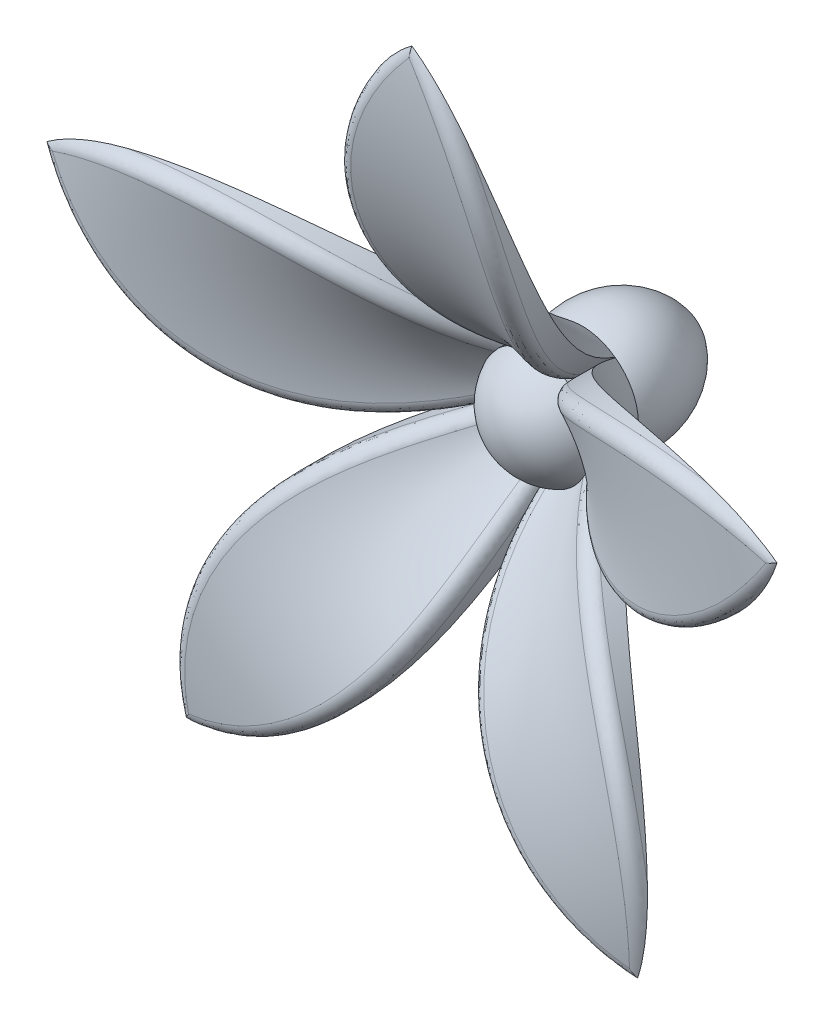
SolidWorks part; units mm, degrees
ref_plane "正面" through (0, 0, 0) normal (0, 0, 1) x (1, 0, 0)
ref_plane "平面" through (0, 0, 0) normal (0, 1, 0) x (1, 0, 0)
ref_plane "右側面" through (0, 0, 0) normal (1, 0, 0) x (0, 0, -1)
sketch "ｽｹｯﾁ1" plane through (0, 0, 0) normal (1, 0, 0) x (0, 0, -1)
  line L0 (22.5323, 0) -> (-103.6484, 0) construction
  line L1 (-20, 0) -> (0, 0)
  arc A0 (0, 0) -> (-110, 157.5) centre (59.9928, 159.0624) cw
  arc A1 (-20, 0) -> (-110, 157.5) centre (25.3033, 130.3519) cw
  dimension "D2" = 170
  dimension "D3" = 138
  dimension "D1" = 110
  dimension "D4" = 315
  dimension "D5" = 20
revolve "回転1" add sketch "ｽｹｯﾁ1" angle 360 about L0
sketch "ｽｹｯﾁ2" plane through (0, 0, 0) normal (0, 0, 1) x (1, 0, 0)
  line L0 (0, 0) -> (0, 196.031) construction
  line L1 (-11.0556, 15.2167) -> (11.0556, 15.2167)
  line L2 (0, 0) -> (62.3495, 85.8167) construction
  line L3 (0, 0) -> (-62.3495, 85.8167) construction
  arc A0 (0, 157.5) -> (11.0556, 15.2167) centre (-77.9363, 79.8731) cw
  arc A1 (0, 157.5) -> (-11.0556, 15.2167) centre (77.9363, 79.8731) ccw
  circle A2 centre (0, 0) radius 157.5 construction
  dimension "D1" = 110
  dimension "D2" = 72
extrude "ｶｯﾄ - 押し出し2" cut sketch "ｽｹｯﾁ2" along normal through all flip side to cut
fillet "ﾌｨﾚｯﾄ1" radius 5 2 edges at (-31.7024, 88.7811, 107.8966) (31.3762, 67.5935, 100.8985)
pattern_circular "円形ﾊﾟﾀｰﾝ1" count 5 over 360
sketch "ｽｹｯﾁ3" plane through (0, 0, 0) normal (1, 0, 0) x (0, 0, -1)
  line L0 (0, 0) -> (-161.1709, 0) construction
  line L1 (0, 0) -> (0, 7.5)
  line L2 (0, 0) -> (-75, 0)
  line L3 (-60, 22.5) -> (-42, 22.5)
  arc A0 (-75, 0) -> (-60, 22.5) centre (-50.0034, -0.4144) cw
  arc A1 (-42, 22.5) -> (0, 7.5) centre (-30.0733, -10.4052) cw
  dimension "D5" = 35
  dimension "D6" = 25
  dimension "D1" = 15
  dimension "D2" = 45
  dimension "D3" = 15
  dimension "D4" = 42
  dimension "D7" = 75
revolve "回転2" add sketch "ｽｹｯﾁ3" angle 360 about L0
